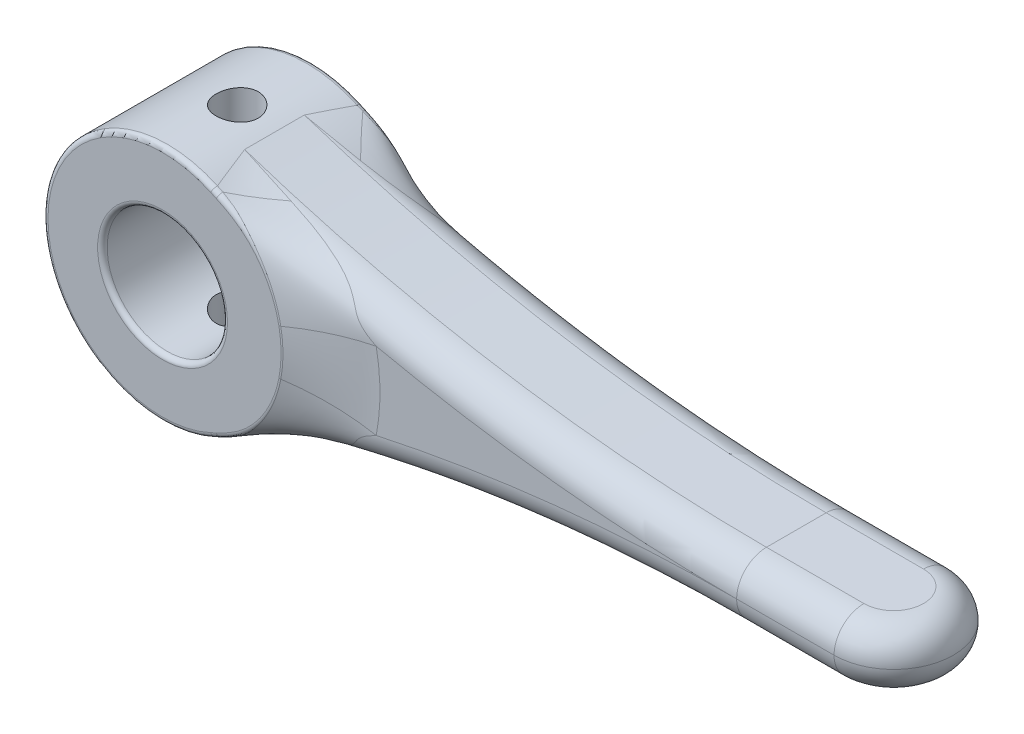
SolidWorks part; units mm, degrees
ref_plane "Front" through (0, 0, 0) normal (0, 0, 1) x (1, 0, 0)
ref_plane "Top" through (0, 0, 0) normal (0, 1, 0) x (1, 0, 0)
ref_plane "Right" through (0, 0, 0) normal (1, 0, 0) x (0, 0, -1)
sketch "Sketch1" plane through (0, 0, 0) normal (0, 0, 1) x (1, 0, 0)
  circle A0 centre (0, 0) radius 6.35
  dimension "D1" = 12.7
extrude "Base-Extrude" add sketch "Sketch1" along normal mid plane 7.9375
sketch "Sketch3" plane through (0, 0, 0) normal (0, 1, 0) x (1, 0, 0)
  line L0 (0, 3.175) -> (34.925, 3.175)
  line L1 (0, 3.175) -> (0, -3.175)
  line L2 (34.925, -3.175) -> (0, -3.175)
  line L4 (0, -3.9688) -> (0, 3.9688) construction
  line L5 (-8.8894, 0) -> (29.3148, 0) construction
  line L6 (-50, 0) -> (50, 0) construction
  arc A0 (34.925, 3.175) -> (34.925, -3.175) centre (34.925, 0) cw
  dimension "D1" = 3.175
  dimension "D2" = 38.1
extrude "Boss-Extrude1" add sketch "Sketch3" along normal mid plane 3.175
fillet "Fillet1" radius 88.9 2 edges at (6.1484, -1.5875, 0) (6.1484, 1.5875, 0)
fillet "Fillet6" radius 1.5875 12 edges at (32.3334, 1.5875, -3.175) (32.3334, -1.5875, -3.175) (15.6855, 2.7058, 3.175) (15.6855, 2.7058, -3.175) (15.6855, -2.7058, 3.175) (15.6855, -2.7058, -3.175) (32.3334, 1.5875, 3.175) (34.925, 0, -3.175) (38.1, -1.5875, 0) (32.3334, -1.5875, 3.175) (38.1, 1.5875, 0) (34.925, 0, 3.175)
fillet "Fillet7" radius 12.7 6 edges at (6.35, 0, -3.175) (6.35, 0, 3.175) (4.6962, 4.2741, -3.0075) (4.6962, -4.2741, -3.0075) (4.6962, 4.2741, 3.0075) (4.6962, -4.2741, 3.0075)
other "Hole1"
sketch "Sketch4" plane through (0, 0, 3.9688) normal (0, 0, 1) x (1, 0, 0)
  circle A0 centre (0, 0) radius 3.2004
  arc A1 (2.7465, 5.7253) -> (2.7465, -5.7253) centre (0, 0) ccw construction
  dimension "D1" = 6.4008
sketch "Sketch5" plane through (0, 0, 0) normal (0, 1, 0) x (1, 0, 0)
  line L0 (0, -3.9688) -> (0, 3.9688) construction
  line L2 (0, -50) -> (0, 50) construction
  line L4 (-50, 0) -> (50, 0) construction
  circle A0 centre (0, 0) radius 1.1187
  dimension "D1" = 2.2374
extrude "Cut-Extrude1" cut sketch "Sketch5" against normal through all and the other way through all
fillet "Fillet12" radius 0.254 12 edges at (3.2004, 0, -3.9688) (3.2004, 0, 3.9688) (5.0254, 3.8817, -3.9688) (5.0254, 3.8817, 3.9688) (-6.35, 0, -3.9688) (5.0254, -3.8817, -3.9688) (6.35, 0, -3.9688) (-6.35, 0, 3.9688) (5.0254, -3.8817, 3.9688) (6.35, 0, 3.9688)
